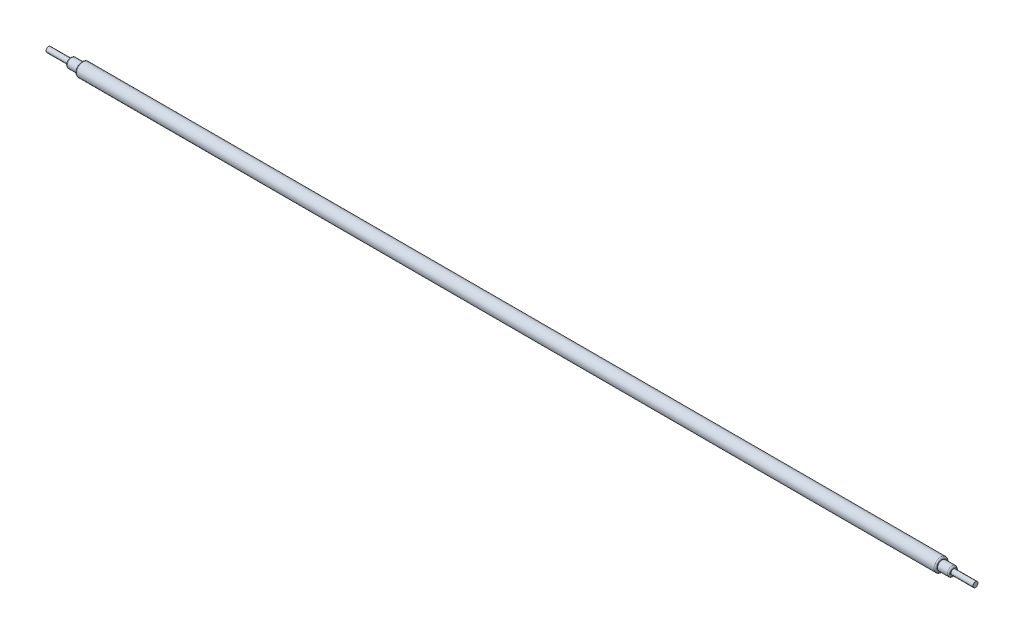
SolidWorks part; units mm, degrees
ref_plane "Plan de face" through (0, 0, 0) normal (0, 0, 1) x (1, 0, 0)
ref_plane "Plan de dessus" through (0, 0, 0) normal (0, 1, 0) x (1, 0, 0)
ref_plane "Plan de droite" through (0, 0, 0) normal (1, 0, 0) x (0, 0, -1)
sketch "Esquisse1" plane through (0, 0, 0) normal (0, 0, 1) x (1, 0, 0)
  line L0 (-347, 0) -> (-347, 1.9)
  line L1 (-347, 1.9) -> (-330.5, 1.9)
  line L2 (-330.5, 1.9) -> (-330.5, 2.5)
  line L3 (-329.5, 3.5) -> (-322, 3.5)
  line L4 (-322, 3.5) -> (-322, 4)
  line L5 (-321, 5) -> (321, 5)
  line L6 (-347, 0) -> (347, 0) construction
  line L7 (0, 0) -> (0, 5) construction
  line L8 (322, 3.5) -> (322, 4)
  line L9 (329.5, 3.5) -> (322, 3.5)
  line L10 (330.5, 1.9) -> (330.5, 2.5)
  line L11 (347, 1.9) -> (330.5, 1.9)
  line L12 (347, 0) -> (347, 1.9)
  line L13 (-347, 0) -> (347, 0)
  arc A0 (-330.5, 2.5) -> (-329.5, 3.5) centre (-329.5, 2.5) cw
  arc A1 (-322, 4) -> (-321, 5) centre (-321, 4) cw
  arc A2 (322, 4) -> (321, 5) centre (321, 4) ccw
  arc A3 (330.5, 2.5) -> (329.5, 3.5) centre (329.5, 2.5) ccw
  dimension "D3" = 1
  dimension "D4" = 1
  dimension "D1" = 694
  dimension "D2" = 3.8
  dimension "D5" = 661
  dimension "D6" = 7
  dimension "D7" = 25
  dimension "D8" = 16.5
  dimension "D9" = 10
revolve "Révolution1" add sketch "Esquisse1" angle 360 about L6
